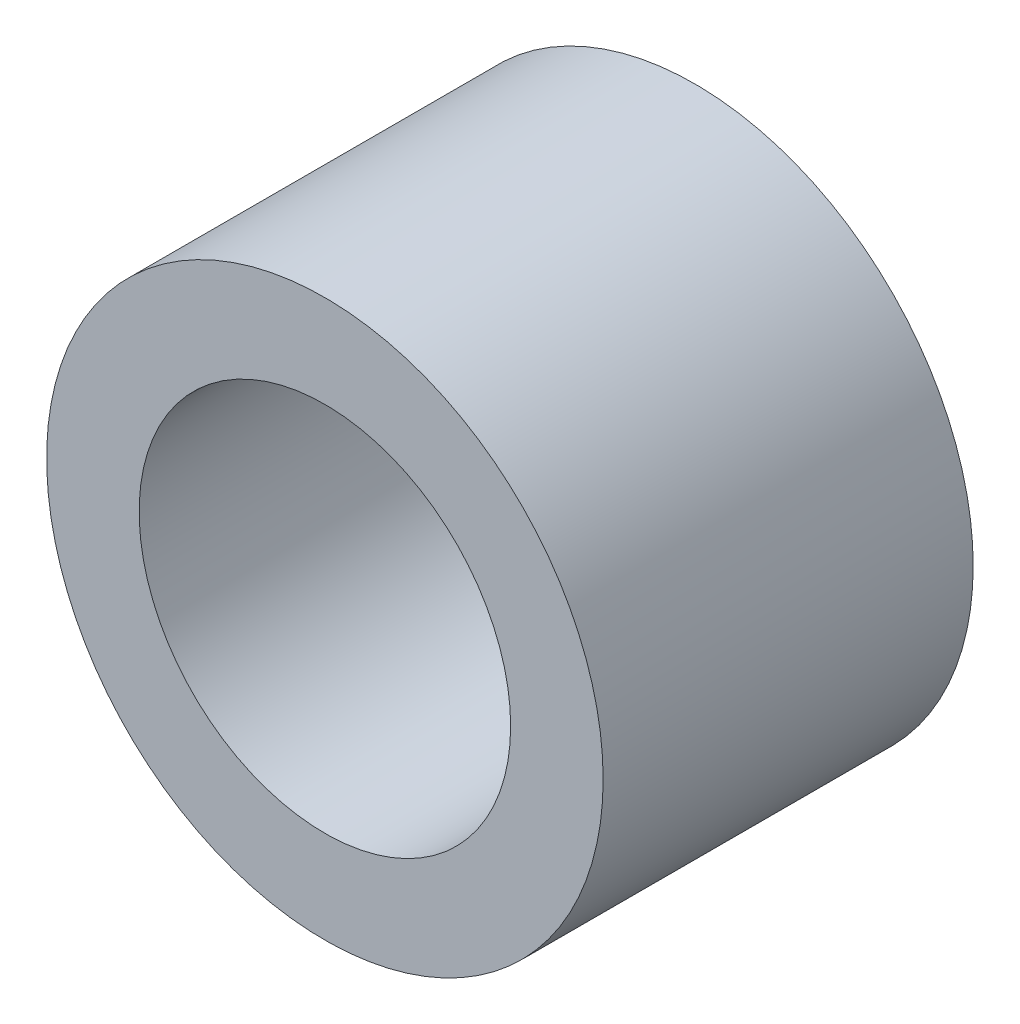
SolidWorks part; units mm, degrees
ref_plane "Front Plane" through (0, 0, 0) normal (0, 0, 1) x (1, 0, 0)
ref_plane "Top Plane" through (0, 0, 0) normal (0, 1, 0) x (1, 0, 0)
ref_plane "Right Plane" through (0, 0, 0) normal (1, 0, 0) x (0, 0, -1)
sketch "Sketch1" plane through (0, 0, 0) normal (0, 0, 1) x (1, 0, 0)
  circle A0 centre (0, 0) radius 4.7752
  circle A1 centre (0, 0) radius 3.1877
  dimension "OD" = 9.5504
  dimension "ID" = 6.3754
sketch "Sketch2" plane through (0, 0, 0) normal (1, 0, 0) x (0, 0, -1)
  line L2 (3.175, 0) -> (-3.175, 0) construction
  line L4 (-3.175, -4.7752) -> (-3.175, 4.7752) construction
  line L5 (-3.175, -3.1877) -> (3.175, -3.1877)
  line L6 (3.175, 3.1877) -> (-3.175, 3.1877)
  line L7 (3.175, -4.7752) -> (3.175, 4.7752) construction
  line L8 (-3.175, 4.7752) -> (3.175, 4.7752) construction
  line L9 (-3.175, -4.7752) -> (3.175, -4.7752) construction
  line L10 (0, 4.7752) -> (0, -4.7752) construction
  line L11 (0, 3.1877) -> (0, -3.1877) construction
  point P4 (0, -3.1877)
  point P7 (0, 3.1877)
  point P8 (0, 0)
  point P12 (-3.175, 0)
  point P15 (3.175, 0)
  point P16 (0, -4.7752)
  point P17 (0, 4.7752)
sketch "Sketch5" plane through (0, 0, 0) normal (0, 0, 1) x (1, 0, 0)
  circle A1 centre (0, 0) radius 3.1877
  circle A2 centre (0, 0) radius 3.1877
  circle A3 centre (0, 0) radius 4.7752
  circle A4 centre (0, 0) radius 4.7752
  dimension "D1" = 0
  dimension "D2" = 0
extrude "Boss-Extrude1" add sketch "Sketch5" along normal up to vertex (3.175 mm away) and the other way up to vertex (3.175 mm away)
sketch "Sketch4" plane through (0, 0, 3.175) normal (0, 0, 1) x (1, 0, 0)
  line L0 (0, 0) -> (-2.254, 2.254)
  line L2 (0, -4.7752) -> (0, 4.7752) construction
  circle A1 centre (0, 0) radius 3.1877 construction
  dimension "D1" = 45
equation "\"D1\"= \"Length@Sketch2\""
